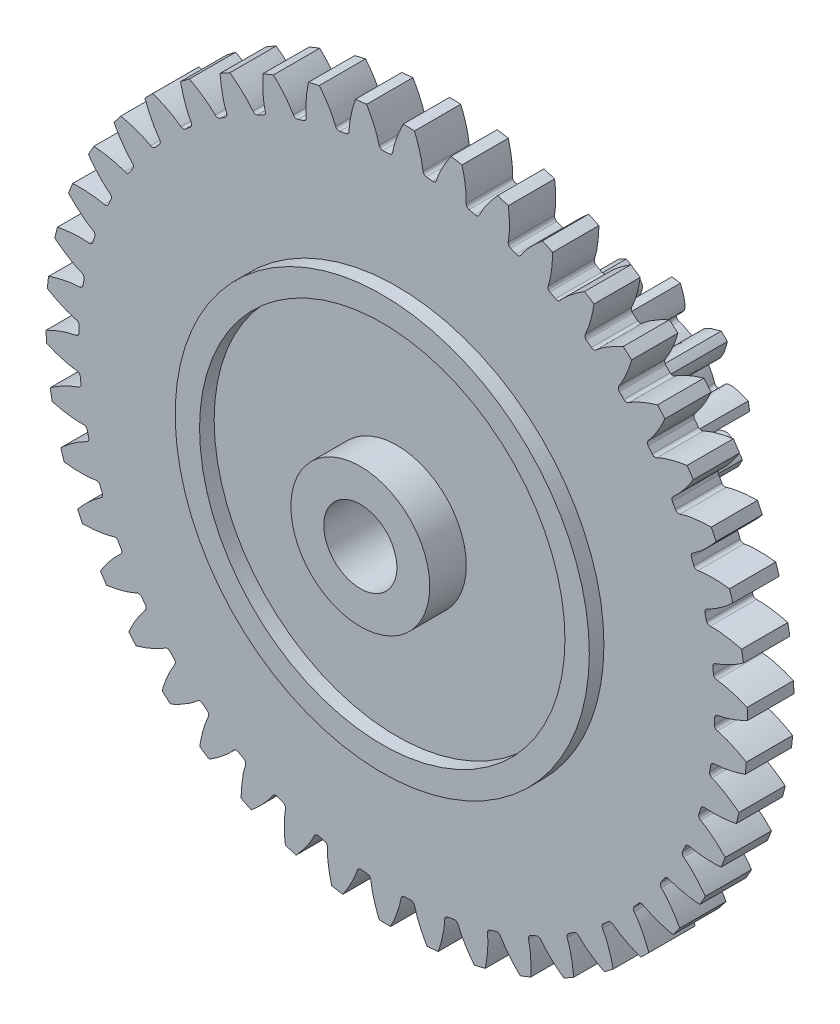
SolidWorks part; units mm, degrees
ref_plane "Face" through (0, 0, 0) normal (0, 0, 1) x (1, 0, 0)
ref_plane "Dessus" through (0, 0, 0) normal (0, 1, 0) x (1, 0, 0)
ref_plane "Droite" through (0, 0, 0) normal (1, 0, 0) x (0, 0, -1)
other "Joindre1"
other "Roue Z2 m=0,3 Z=46<1>@Z2-Z3"
other "Roue Z3 m=0,3 Z=10<1>@Z2-Z3"
sketch "Dp" plane through (0, 0, 0) normal (0, 0, 1) x (1, 0, 0)
  circle A0 centre (0, 0) radius 6.9 construction
  circle A1 centre (0, 0) radius 1.5 construction
  dimension "D1" = 13.8
  dimension "D2" = 3
